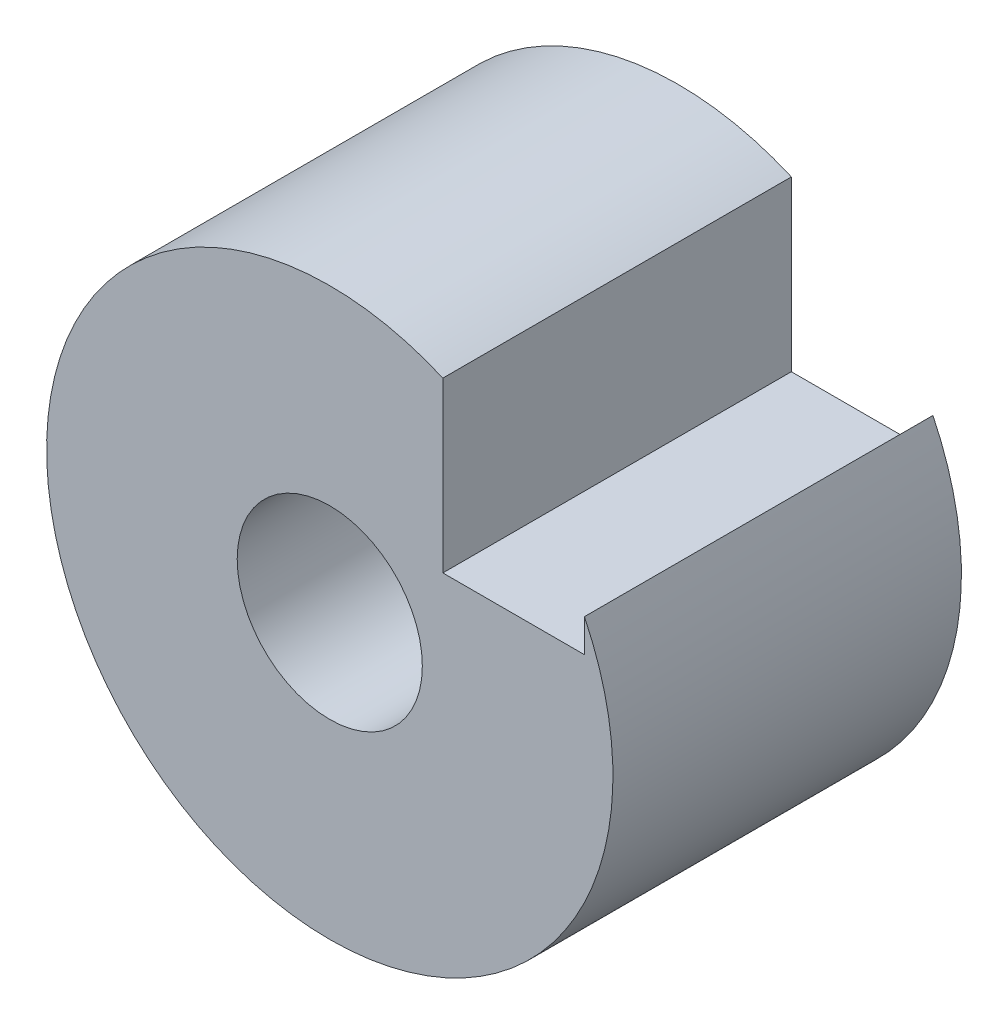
SolidWorks part; units mm, degrees
ref_plane "Front Plane" through (0, 0, 0) normal (0, 0, 1) x (1, 0, 0)
ref_plane "Top Plane" through (0, 0, 0) normal (0, 1, 0) x (1, 0, 0)
ref_plane "Right Plane" through (0, 0, 0) normal (1, 0, 0) x (0, 0, -1)
sketch "Sketch1" plane through (0, 0, 0) normal (0, 0, 1) x (1, 0, 0)
  circle A0 centre (0, 0) radius 13
  dimension "D1" = 26
extrude "Boss-Extrude1" add sketch "Sketch1" along normal blind 16
sketch "Sketch2" plane through (0, 0, 16) normal (0, 0, 1) x (1, 0, 0)
  circle A0 centre (0, 0) radius 4.25
  dimension "D1" = 8.5
extrude "Cut-Extrude1" cut sketch "Sketch2" against normal blind 16
sketch "Sketch3" plane through (0, 0, 16) normal (0, 0, 1) x (1, 0, 0)
  line L0 (-0.8085, 4.1724) -> (16.5582, 4.1724) construction
  line L2 (5.1915, 15.6004) -> (11.6915, 15.6004)
  line L3 (5.1915, 15.6004) -> (5.1915, 4.1724)
  line L4 (5.1915, 4.1724) -> (11.6915, 4.1724)
  line L5 (11.6915, 15.6004) -> (11.6915, 4.1724)
  line L6 (5.1915, 15.6004) -> (11.6915, 4.1724) construction
  line L7 (5.1915, 4.1724) -> (11.6915, 15.6004) construction
  circle A0 centre (0, 0) radius 4.25 construction
  circle A1 centre (0, 0) radius 13 construction
  point P4 (8.4415, 9.8864)
  dimension "D1" = 6.5
  dimension "D2" = 6
extrude "Cut-Extrude2" cut sketch "Sketch3" against normal blind 16
